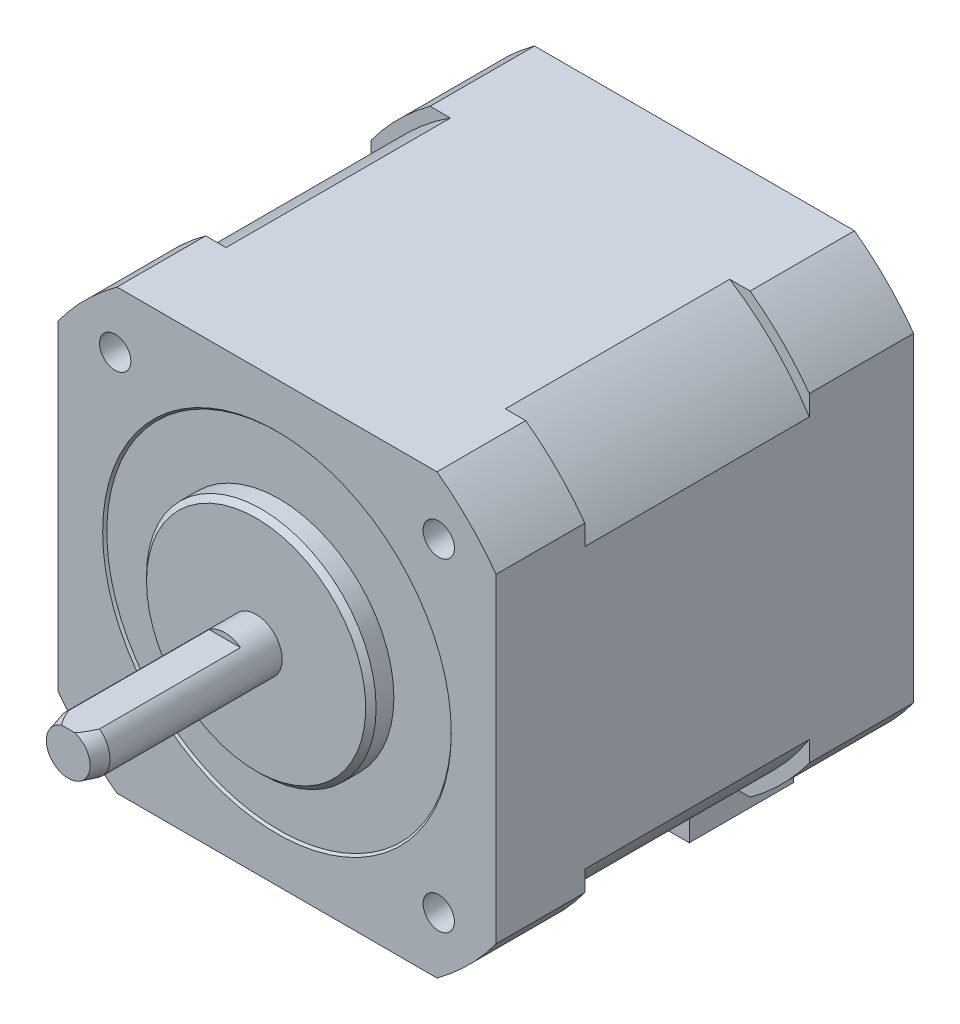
SolidWorks part; units mm, degrees
ref_plane "正面" through (0, 0, 0) normal (0, 0, 1) x (1, 0, 0)
ref_plane "平面" through (0, 0, 0) normal (0, 1, 0) x (1, 0, 0)
ref_plane "右側面" through (0, 0, 0) normal (1, 0, 0) x (0, 0, -1)
sketch "ｽｹｯﾁ1" plane through (0, 0, 0) normal (0, 0, 1) x (1, 0, 0)
  circle A0 centre (0, 0) radius 2.5
  dimension "D1" = 5
extrude "押し出し1" add sketch "ｽｹｯﾁ1" along normal blind 18
sketch "ｽｹｯﾁ2" plane through (0, 0, 0) normal (0, 0, -1) x (-1, 0, 0)
  circle A0 centre (0, 0) radius 11
  dimension "D1" = 22
extrude "押し出し2" add sketch "ｽｹｯﾁ2" along normal blind 2
sketch "ｽｹｯﾁ3" plane through (0, 0, -2) normal (0, 0, -1) x (-1, 0, 0)
  line L1 (-21, 21) -> (21, 21)
  line L2 (-21, 21) -> (-21, -21)
  line L3 (-21, -21) -> (21, -21)
  line L4 (21, 21) -> (21, -21)
  line L5 (-21, 21) -> (21, -21) construction
  line L6 (-21, -21) -> (21, 21) construction
  point P0 (0, 0)
  point P6 (0, 0)
  dimension "D1" = 42
  dimension "D2" = 42
extrude "押し出し3" add sketch "ｽｹｯﾁ3" along normal blind 8.5
sketch "Sketch8" plane through (0, 0, -2) normal (0, 0, 1) x (1, 0, 0)
  circle A0 centre (0, 0) radius 26
  dimension "D1" = 52
extrude "Extrude8" cut sketch "Sketch8" against normal blind 34 flip side to cut
sketch "Sketch9" plane through (0, 0, -10.5) normal (0, 0, -1) x (-1, 0, 0)
  line L4 (-21, 15.3297) -> (-21, -15.3297) construction
  line L5 (-15.3297, -21) -> (15.3297, -21) construction
  line L6 (21, -15.3297) -> (21, 15.3297) construction
  line L7 (15.3297, 21) -> (-15.3297, 21) construction
  line L8 (-21, 13.3795) -> (-21, -13.3795)
  line L9 (-13.3795, -21) -> (13.3795, -21)
  line L10 (21, -13.3795) -> (21, 13.3795)
  line L11 (13.3795, 21) -> (-13.3795, 21)
  arc A1 (21, 13.3795) -> (13.3795, 21) centre (0, 0) ccw
  arc A2 (-13.3795, 21) -> (-21, 13.3795) centre (0, 0) ccw
  arc A3 (-21, -13.3795) -> (-13.3795, -21) centre (0, 0) ccw
  arc A4 (13.3795, -21) -> (21, -13.3795) centre (0, 0) ccw
  dimension "D1" = 49.8
extrude "Extrude9" add sketch "Sketch9" along normal blind 21.5
sketch "Sketch14" plane through (0, 0, -2) normal (0, 0, 1) x (1, 0, 0)
  line L5 (15.5, -15.5) -> (-15.5, 15.5) construction
  line L6 (15.5, 15.5) -> (-15.5, -15.5) construction
  circle A0 centre (-15.5, 15.5) radius 1.5
  circle A1 centre (15.5, 15.5) radius 1.5
  circle A2 centre (15.5, -15.5) radius 1.5
  circle A3 centre (-15.5, -15.5) radius 1.5
  point P0 (0, 0)
  dimension "D3" = 3
  dimension "D4" = 3
  dimension "D5" = 3
  dimension "D6" = 3
  dimension "D1" = 31
  dimension "D2" = 31
  dimension "D7" = 15.5
  dimension "D8" = 15.5
  dimension "D9" = 31
  dimension "D10" = 31
extrude "Extrude13" cut sketch "Sketch14" against normal blind 4.5
sketch "Sketch11" plane through (0, 0, -32) normal (0, 0, -1) x (-1, 0, 0)
  line L0 (-21, 13.3795) -> (-21, -13.3795) construction
  line L1 (-21, 15.3297) -> (-21, 13.3795) construction
  line L2 (-21, -13.3795) -> (-21, -15.3297) construction
  line L3 (-13.3795, -21) -> (13.3795, -21) construction
  line L4 (-15.3297, -21) -> (-13.3795, -21) construction
  line L5 (13.3795, -21) -> (15.3297, -21) construction
  line L6 (21, -15.3297) -> (21, -13.3795) construction
  line L7 (21, -13.3795) -> (21, 13.3795) construction
  line L8 (21, 13.3795) -> (21, 15.3297) construction
  line L9 (15.3297, 21) -> (13.3795, 21) construction
  line L10 (-13.3795, 21) -> (-15.3297, 21) construction
  line L11 (-21, 13.3795) -> (-21, -13.3795)
  line L12 (-21, 15.3297) -> (-21, 13.3795)
  line L13 (-21, -13.3795) -> (-21, -15.3297)
  line L14 (-13.3795, -21) -> (13.3795, -21)
  line L15 (-15.3297, -21) -> (-13.3795, -21)
  line L16 (13.3795, -21) -> (15.3297, -21)
  line L17 (21, -15.3297) -> (21, -13.3795)
  line L18 (21, -13.3795) -> (21, 13.3795)
  line L19 (21, 13.3795) -> (21, 15.3297)
  line L20 (15.3297, 21) -> (13.3795, 21)
  line L21 (-13.3795, 21) -> (-15.3297, 21)
  line L22 (13.3795, 21) -> (-13.3795, 21) construction
  line L23 (13.3795, 21) -> (-13.3795, 21)
  arc A0 (-15.3297, 21) -> (-21, 15.3297) centre (0, 0) ccw construction
  arc A1 (-21, -15.3297) -> (-15.3297, -21) centre (0, 0) ccw construction
  arc A2 (15.3297, -21) -> (21, -15.3297) centre (0, 0) ccw construction
  arc A3 (21, 15.3297) -> (15.3297, 21) centre (0, 0) ccw construction
  arc A4 (-15.3297, 21) -> (-21, 15.3297) centre (0, 0) ccw
  arc A5 (-21, -15.3297) -> (-15.3297, -21) centre (0, 0) ccw
  arc A6 (15.3297, -21) -> (21, -15.3297) centre (0, 0) ccw
  arc A7 (21, 15.3297) -> (15.3297, 21) centre (0, 0) ccw
extrude "Extrude11" add sketch "Sketch11" along normal blind 10
chamfer "Chamfer5" distance 1.5 angle 15 1 edges at (2.5, 0, 18)
sketch "Sketch2" plane through (0, 0, 18) normal (0, 0, 1) x (1, 0, 0)
  line L1 (-4.7278, 5.1185) -> (3.4221, 5.1185)
  line L2 (-4.7278, 5.1185) -> (-4.7278, 2)
  line L3 (-4.7278, 2) -> (3.4221, 2)
  line L4 (3.4221, 5.1185) -> (3.4221, 2)
  dimension "D1" = 2
extrude "Extrude2" cut sketch "Sketch2" against normal blind 15
sketch "Sketch6" plane through (0, 0, -2) normal (0, 0, 1) x (1, 0, 0)
  circle A0 centre (0, 0) radius 16.5
  circle A1 centre (0, 0) radius 11 construction
  circle A2 centre (0, 0) radius 11
  dimension "D2" = 33
extrude "Extrude6" cut sketch "Sketch6" against normal blind 0.2
chamfer "Chamfer2" distance 0.5 angle 45 1 edges at (-11, 0, 0)
chamfer "Chamfer7" distance 0.2 angle 45 1 edges at (16.5, 0, -2)
sketch "Sketch13" plane through (0, -21, 0) normal (0, -1, 0) x (1, 0, 0)
  line L0 (15.3297, -42) -> (-15.3297, -42) construction
  line L1 (-9.5, -32) -> (9.5, -32)
  line L2 (-9.5, -32) -> (-9.5, -42)
  line L3 (-9.5, -42) -> (9.5, -42)
  line L4 (9.5, -32) -> (9.5, -42)
  line L5 (-21, -42) -> (-21, -32) construction
  dimension "D1" = 10
  dimension "11.5" = 11.5
  dimension "D2" = 19
extrude "Extrude12" add sketch "Sketch13" along normal blind 6.7
